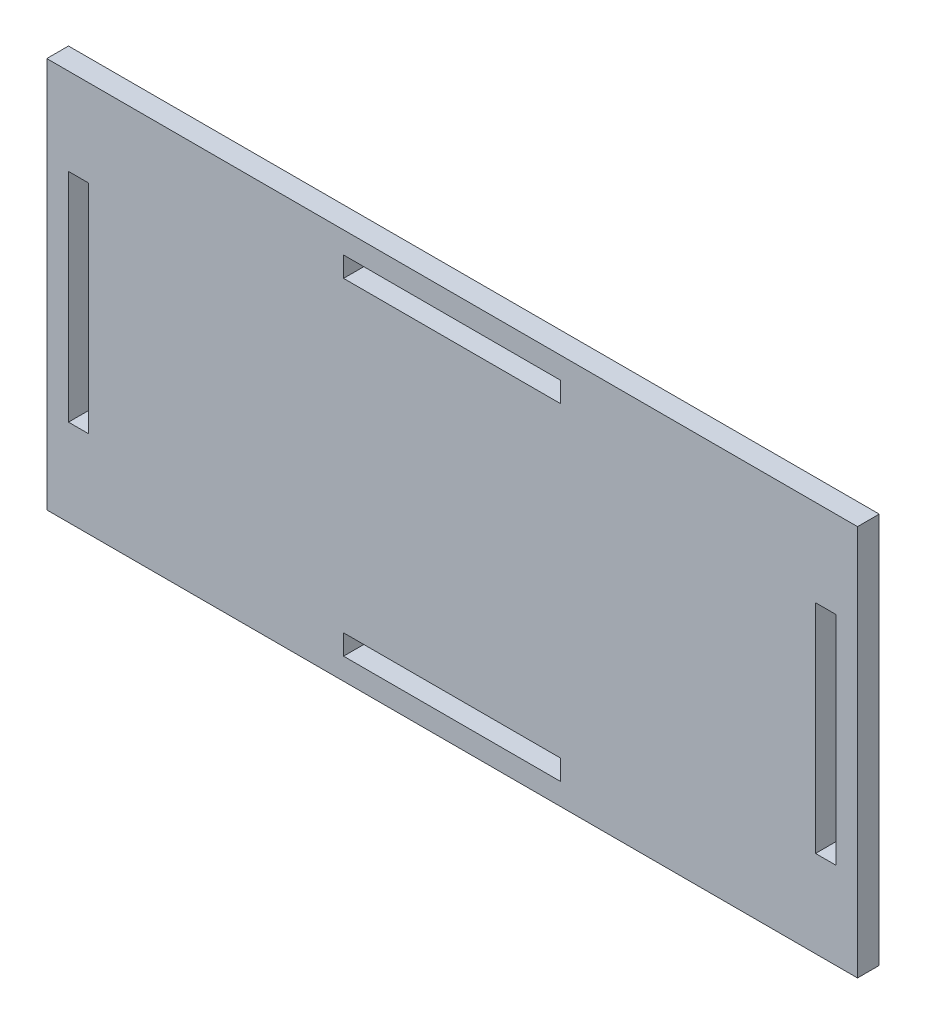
SolidWorks part; units mm, degrees
ref_plane "Alzado" through (0, 0, 0) normal (0, 0, 1) x (1, 0, 0)
ref_plane "Planta" through (0, 0, 0) normal (0, 1, 0) x (1, 0, 0)
ref_plane "Vista lateral" through (0, 0, 0) normal (1, 0, 0) x (0, 0, -1)
sketch "Croquis1" plane through (0, 0, 0) normal (0, 0, 1) x (1, 0, 0)
  line L0 (0, 0) -> (-35.0294, 0) construction
  line L1 (-56, -27) -> (56, -27)
  line L2 (-56, -27) -> (-56, 27)
  line L3 (-56, 27) -> (56, 27)
  line L4 (56, -27) -> (56, 27)
  line L5 (-56, -27) -> (56, 27) construction
  line L6 (-56, 27) -> (56, -27) construction
  line L7 (-15, 21.2) -> (15, 21.2)
  line L8 (-15, 21.2) -> (-15, 24)
  line L9 (-15, 24) -> (15, 24)
  line L10 (15, 21.2) -> (15, 24)
  line L11 (-15, 21.2) -> (15, 24) construction
  line L12 (-15, 24) -> (15, 21.2) construction
  line L13 (-53, -15) -> (-50.2, -15)
  line L14 (-53, -15) -> (-53, 15)
  line L15 (-53, 15) -> (-50.2, 15)
  line L16 (-50.2, -15) -> (-50.2, 15)
  line L17 (-53, -15) -> (-50.2, 15) construction
  line L18 (-53, 15) -> (-50.2, -15) construction
  line L19 (0, 0) -> (0, 13.6367) construction
  line L20 (-15, -24) -> (15, -21.2) construction
  line L21 (-15, -21.2) -> (15, -24) construction
  line L22 (15, -21.2) -> (15, -24)
  line L23 (-15, -24) -> (15, -24)
  line L24 (-15, -21.2) -> (-15, -24)
  line L25 (-15, -21.2) -> (15, -21.2)
  line L26 (53, 15) -> (50.2, -15) construction
  line L27 (53, -15) -> (50.2, 15) construction
  line L28 (50.2, -15) -> (50.2, 15)
  line L29 (53, 15) -> (50.2, 15)
  line L30 (53, -15) -> (53, 15)
  line L31 (53, -15) -> (50.2, -15)
  point P0 (0, 0)
  point P6 (0, 22.6)
  point P11 (-51.6, 0)
  point P17 (0, 27)
  point P19 (-56, 0)
  point P25 (0, -22.6)
  point P30 (51.6, 0)
  dimension "D1" = 112
  dimension "D2" = 54
  dimension "D3" = 3
  dimension "D4" = 2.8
  dimension "D5" = 30
  dimension "D6" = 3
  dimension "D7" = 2.8
  dimension "D8" = 30
extrude "Saliente-Extruir1" add sketch "Croquis1" along normal blind 3
